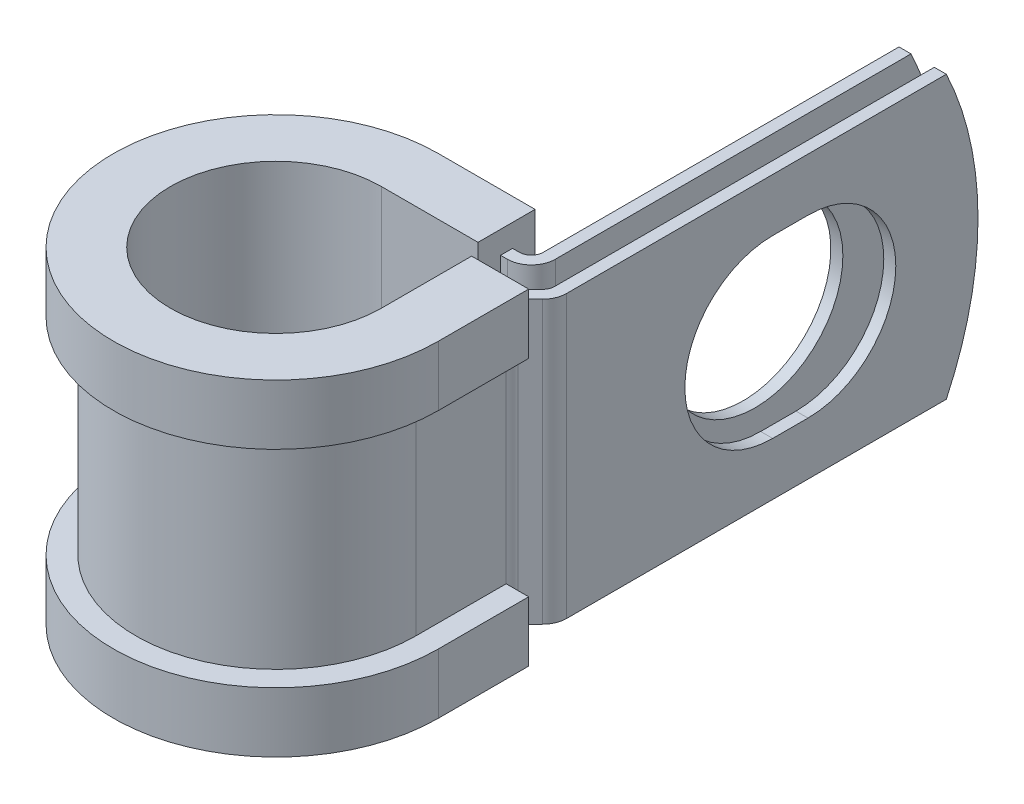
SolidWorks part; units mm, degrees
ref_plane "Front Plane" through (0, 0, 0) normal (0, 0, 1) x (1, 0, 0)
ref_plane "Top Plane" through (0, 0, 0) normal (0, 1, 0) x (1, 0, 0)
ref_plane "Right Plane" through (0, 0, 0) normal (1, 0, 0) x (0, 0, -1)
sketch "Sketch1" plane through (0, 0, 0) normal (0, 1, 0) x (1, 0, 0)
  line L0 (0, 8.6614) -> (7.0014, 8.6614)
  line L1 (8.6614, 0) -> (8.6614, 6.111)
  line L2 (8.627, 36.4998) -> (8.627, 10.287)
  line L3 (9.1375, 7.2605) -> (9.9637, 8.0867)
  line L5 (10.2018, 8.6614) -> (10.2018, 36.4998)
  arc A0 (0, 8.6614) -> (8.6614, 0) centre (0, 0) ccw
  arc A1 (9.1375, 7.2605) -> (8.6614, 6.111) centre (10.287, 6.111) ccw
  arc A2 (9.9637, 8.0867) -> (10.2018, 8.6614) centre (9.389, 8.6614) ccw
  arc A3 (7.0014, 8.6614) -> (8.627, 10.287) centre (7.0014, 10.287) ccw
extrude "Extrude-Thin1" add sketch "Sketch1" along normal mid plane 19.05 thin
sketch "Sketch2" plane through (7.8142, 0, 0) normal (-1, 0, 0) x (0, 0, 1)
  line L0 (-36.4998, 9.525) -> (-36.4998, -9.525) construction
  line L1 (0, 9.525) -> (0, -9.525) construction
  circle A0 centre (-23.7998, 0) radius 5.9436
  point P2 (-36.4998, 0)
extrude "Cut-Extrude1" cut sketch "Sketch2" against normal up to surface (0.8128 mm away)
sketch "Sketch3" plane through (11.0146, 0, 0) normal (1, 0, 0) x (0, 0, -1)
  line L0 (22.606, 0) -> (24.9936, 0) construction
  line L1 (22.606, 5.9436) -> (24.9936, 5.9436)
  line L2 (22.606, -5.9436) -> (24.9936, -5.9436)
  line L3 (36.4998, 9.525) -> (36.4998, -9.525) construction
  arc A0 (22.606, 5.9436) -> (22.606, -5.9436) centre (22.606, 0) ccw
  arc A1 (24.9936, -5.9436) -> (24.9936, 5.9436) centre (24.9936, 0) ccw
  point P3 (23.7998, 0)
  point P8 (36.4998, 0)
  point P11 (16.6624, 0)
  point P12 (30.9372, 0)
extrude "Cut-Extrude2" cut sketch "Sketch3" against normal up to surface (0.8128 mm away)
sketch "Sketch4" plane through (7.8142, 0, 0) normal (-1, 0, 0) x (0, 0, 1)
  line L0 (-36.4998, 9.525) -> (-36.4998, -9.525)
  line L1 (-36.4998, 9.525) -> (-34.3553, 9.525)
  line L2 (-36.4998, 9.525) -> (-10.287, 9.525) construction
  line L3 (-36.4998, -9.525) -> (-34.3553, -9.525)
  line L4 (-36.4998, -9.525) -> (-10.287, -9.525) construction
  arc A0 (-34.3553, 9.525) -> (-34.3553, -9.525) centre (-14.2748, 0) ccw
extrude "Cut-Extrude3" cut sketch "Sketch4" against normal through all contours A0 M4 M5 | A0 L0 M2
ref_plane "Plane1" through (0, 0, -6.111) normal (0, 0, -1) x (-1, 0, 0)
ref_plane "Plane2" through (6.5442, 0, 0) normal (-1, 0, 0) x (0, 0, 1)
sketch "Sketch5" plane through (0, 0, -6.111) normal (0, 0, -1) x (-1, 0, 0)
  line L0 (-9.4742, 9.525) -> (-8.6614, 9.525)
  line L1 (-9.4742, 9.525) -> (-9.4742, -9.525) construction
  line L3 (-8.6614, 9.525) -> (-8.6614, -9.525)
  line L4 (-8.6614, -9.525) -> (-9.4742, -9.525)
  line L5 (-9.4742, -9.525) -> (-9.4742, -6.985)
  line L6 (-9.4742, 9.525) -> (-9.4742, 6.985)
  line L7 (-10.9982, 11.049) -> (-10.9982, 6.985)
  line L8 (-10.9982, 11.049) -> (-7.1374, 11.049)
  line L9 (-7.1374, 11.049) -> (-7.1374, -11.049)
  line L10 (-7.1374, -11.049) -> (-10.9982, -11.049)
  line L11 (-10.9982, -11.049) -> (-10.9982, -6.985)
  line L12 (-10.9982, 6.985) -> (-9.4742, 6.985)
  line L13 (-9.4742, -6.985) -> (-10.9982, -6.985)
sketch "Sketch6" plane through (0, 9.525, 0) normal (0, 1, 0) x (1, 0, 0)
  line L0 (7.1374, 0) -> (7.1374, 6.111)
  line L1 (7.1374, 6.111) -> (10.9982, 6.111) construction
  line L2 (6.5442, 6.9878) -> (6.5442, -6.9878) construction
  line L5 (0, 7.1374) -> (6.5442, 7.1374)
  arc A0 (0, 7.1374) -> (7.1374, 0) centre (0, 0) ccw
sweep "Sweep1" add profiles "Sketch5" path "Sketch6"
equation "\"D4@Sketch5\" = \"D1@Extrude-Thin1\""
equation "\"D5@Sketch5\" = \"D5@Extrude-Thin1\""
equation "\"D1@Sketch3\" = \"D2@Sketch2\""
equation "\"D7@Sketch1\" = \"D3@Sketch2\" + \"D1@Sketch3\""
equation "\"D1@Sketch1\" = \"D1@Sketch6\" + 2 * \"D3@Sketch5\""
equation "\"D1@Sketch4\" = ( \"D1@Extrude-Thin1\" + .125 ) * 2"
equation "\"D9@Sketch1\"= \"D5@Extrude-Thin1\""
equation "\"D8@Sketch1\"= 2 * \"D5@Extrude-Thin1\""
equation "\"D2@Sketch1\" = 2 * \"D5@Extrude-Thin1\""
equation "\"D2@Sketch3\" = \"D1@Sketch2\""
